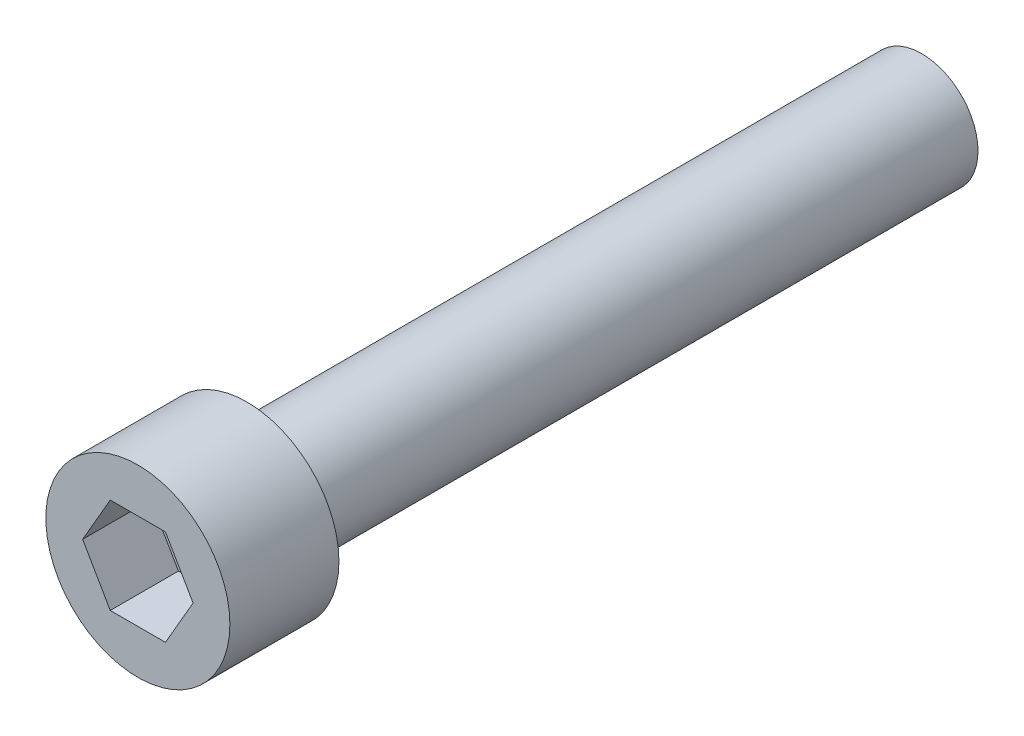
SolidWorks part; units mm, degrees
ref_plane "Front Plane" through (0, 0, 0) normal (0, 0, 1) x (1, 0, 0)
ref_plane "Top Plane" through (0, 0, 0) normal (0, 1, 0) x (1, 0, 0)
ref_plane "Right Plane" through (0, 0, 0) normal (1, 0, 0) x (0, 0, -1)
sketch "Sketch1" plane through (0, 0, 0) normal (0, 0, 1) x (1, 0, 0)
  circle A0 centre (0, 0) radius 3.429
  dimension "D1" = 6.858
extrude "Boss-Extrude1" add sketch "Sketch1" along normal blind 4.064
sketch "Sketch2" plane through (0, 0, 4.064) normal (0, 0, 1) x (1, 0, 0)
  circle A0 centre (0, 0) radius 2.0955
  dimension "D1" = 4.191
extrude "Boss-Extrude2" add sketch "Sketch2" against normal blind 29.21
sketch "Sketch3" plane through (0, 0, 4.064) normal (0, 0, 1) x (1, 0, 0)
  line L1 (2.0574, 0) -> (1.0287, 1.7818)
  line L2 (1.0287, 1.7818) -> (-1.0287, 1.7818)
  line L3 (-1.0287, 1.7818) -> (-2.0574, 0)
  line L4 (-2.0574, 0) -> (-1.0287, -1.7818)
  line L5 (-1.0287, -1.7818) -> (1.0287, -1.7818)
  line L6 (1.0287, -1.7818) -> (2.0574, 0)
  circle A0 centre (0, 0) radius 1.7818 construction
  dimension "D1" = 4.1148
extrude "Cut-Extrude1" cut sketch "Sketch3" against normal blind 2.54
